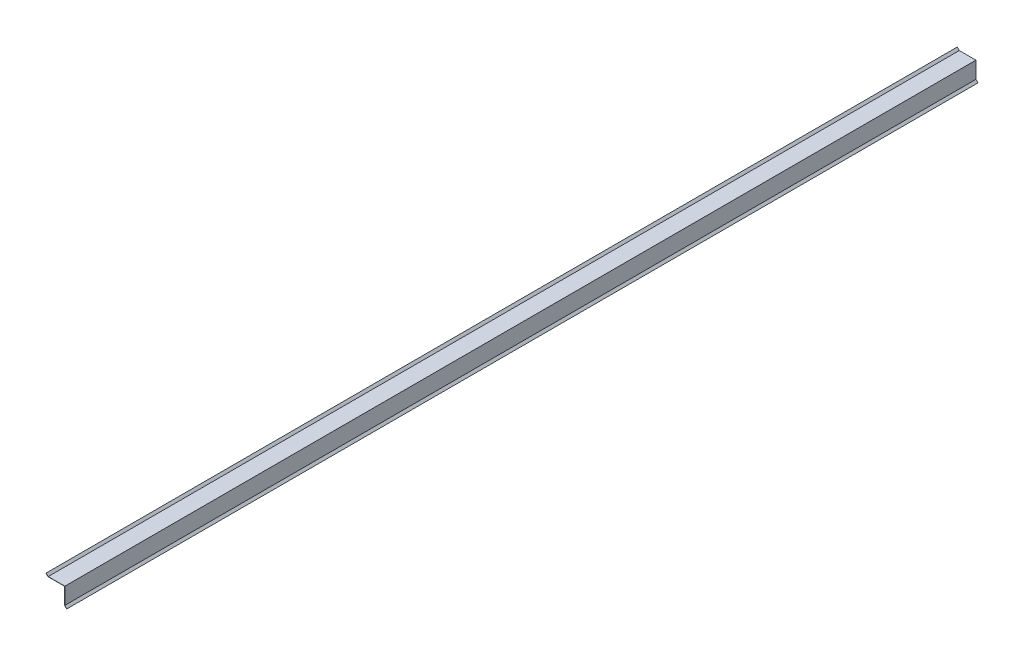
SolidWorks part; units mm, degrees
ref_plane "Front" through (0, 0, 0) normal (0, 0, 1) x (1, 0, 0)
ref_plane "Top" through (0, 0, 0) normal (0, 1, 0) x (1, 0, 0)
ref_plane "Right" through (0, 0, 0) normal (1, 0, 0) x (0, 0, -1)
sketch "Sketch1" plane through (0, 0, 0) normal (0, 0, 1) x (1, 0, 0)
  line L0 (0, -36.5125) -> (4.4901, -41.0026)
  line L1 (-36.5125, 0) -> (0, 0)
  line L2 (-36.5125, 0) -> (-41.0026, 4.4901)
  line L5 (0, -36.5125) -> (0, 0)
  line L6 (0, 0) -> (17.4519, 17.4519) construction
  dimension "D3" = 36.5125
  dimension "D2" = 6.35
  dimension "D1" = 45
extrude "Extrude-Thin1" add sketch "Sketch1" along normal blind 2000 thin
